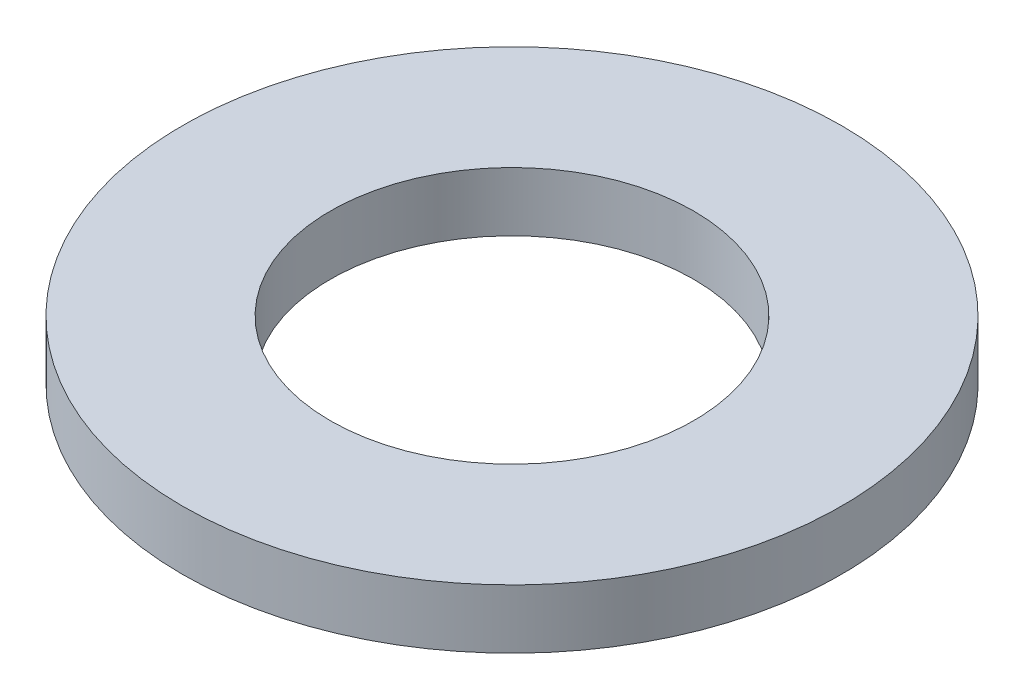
SolidWorks part; units mm, degrees
ref_plane "Front" through (0, 0, 0) normal (0, 0, 1) x (1, 0, 0)
ref_plane "Top" through (0, 0, 0) normal (0, 1, 0) x (1, 0, 0)
ref_plane "Right" through (0, 0, 0) normal (1, 0, 0) x (0, 0, -1)
sketch "Sketch1" plane through (0, 0, 0) normal (0, 1, 0) x (1, 0, 0)
  circle A0 centre (0, 0) radius 21.5
  circle A1 centre (0, 0) radius 39
extrude "Extrude1" add sketch "Sketch1" along normal blind 7
